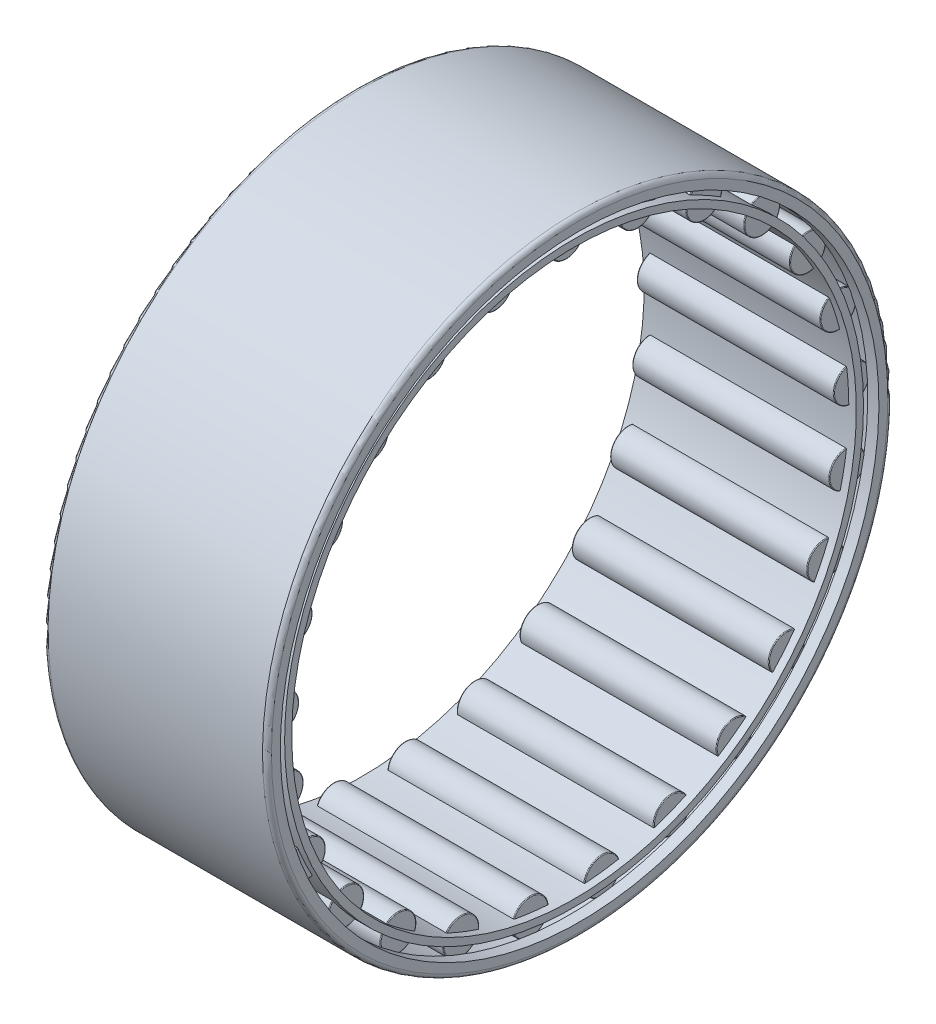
SolidWorks part; units mm, degrees
ref_plane "Plane1" through (0, 0, 0) normal (0, 0, 1) x (1, 0, 0)
ref_plane "Plane2" through (0, 0, 0) normal (0, 1, 0) x (1, 0, 0)
ref_plane "Plane3" through (0, 0, 0) normal (1, 0, 0) x (0, 0, -1)
other "Configuration Table"
sketch "Clipboard" plane through (0, 0, 0) normal (0, 0, 1) x (1, 0, 0)
  line L0 (-10, 0) -> (10, 0) construction
  line L1 (0, 0) -> (20.2657, -9.45)
  line L2 (0, 0) -> (36.8323, 17.1752)
  line L3 (0, 0) -> (20.2657, -9.45)
  line L4 (0, 0) -> (-76.2, -2.661)
sketch "InnRacSke" plane through (0, 0, 0) normal (0, 0, 1) x (1, 0, 0)
  line L0 (-14.2875, 42.545) -> (-15.875, 42.545)
  line L1 (-15.875, 42.545) -> (-15.875, 43.815)
  line L2 (-15.24, 44.45) -> (15.24, 44.45)
  line L4 (15.875, 43.815) -> (15.875, 42.545)
  line L5 (15.875, 42.545) -> (14.2875, 42.545)
  line L6 (14.2875, 42.545) -> (14.2875, 43.18)
  line L7 (14.2875, 43.18) -> (-14.2875, 43.18)
  line L8 (-14.2875, 43.18) -> (-14.2875, 42.545)
  line L9 (-31.75, 0) -> (31.75, 0) construction
  arc A0 (-15.875, 43.815) -> (-15.24, 44.45) centre (-15.24, 43.815) cw
  arc A2 (15.24, 44.45) -> (15.875, 43.815) centre (15.24, 43.815) cw
revolve "Race" add sketch "InnRacSke" angle 360 about L9
sketch "RolDetSke" plane through (0, 0, 0) normal (0, 0, 1) x (1, 0, 0)
  line L0 (-14.0018, 43.0789) -> (-14.0017, 40.64)
  line L1 (-14.0017, 40.64) -> (14.0017, 40.64)
  line L2 (14.0017, 40.64) -> (14.0018, 43.0789)
  line L3 (13.9001, 43.1805) -> (-13.9001, 43.1805)
  line L4 (-28.575, 40.64) -> (28.575, 40.64) construction
  arc A0 (14.0018, 43.0789) -> (13.9001, 43.1805) centre (13.9001, 43.0789) ccw
  arc A1 (-13.9001, 43.1805) -> (-14.0018, 43.0789) centre (-13.9001, 43.0789) ccw
revolve "RollerDetailed" add sketch "RolDetSke" angle 360 about L4
ref_axis "Axis1" through (-50, 0, 0) along (1, 0, 0)
sketch "CagSpiSke" plane through (0, 0, 0) normal (0, 0, 1) x (1, 0, 0)
  line L0 (15.0812, 40.1319) -> (15.0812, 41.1481)
  line L1 (15.0812, 41.1481) -> (-15.0813, 41.1481)
  line L2 (-15.0813, 41.1481) -> (-15.0813, 40.1319)
  line L3 (-15.0813, 40.1319) -> (15.0812, 40.1319)
  line L4 (-31.75, 0) -> (31.75, 0) construction
revolve "CageSpine" add sketch "CagSpiSke" angle 360 about L4
pattern_circular "RollersDetailed" count 25 every 14.4 about axis through (-50, 0, 0) along (1, 0, 0) of "RollerDetailed"
sketch "RolSimSke" plane through (0, 0, 0) normal (0, 0, 1) x (1, 0, 0)
  line L0 (-25.4, 0) -> (25.4, 0) construction
  line L2 (-13.9001, 43.181) -> (13.9001, 43.181)
  line L3 (-14.0018, 43.0794) -> (-14.0018, 38.2016)
  line L4 (-13.9001, 38.1) -> (13.9001, 38.1)
  line L5 (14.0017, 43.0794) -> (14.0017, 38.2016)
  arc A0 (-14.0018, 38.2016) -> (-13.9001, 38.1) centre (-13.9001, 38.2016) ccw
  arc A1 (-13.9001, 43.181) -> (-14.0018, 43.0794) centre (-13.9001, 43.0794) ccw
  arc A2 (14.0017, 43.0794) -> (13.9001, 43.181) centre (13.9001, 43.0794) ccw
  arc A3 (13.9001, 38.1) -> (14.0017, 38.2016) centre (13.9001, 38.2016) ccw
  point P10 (-14.0018, 38.1)
  point P15 (14.0017, 43.181)
  point P18 (14.0017, 38.1)
revolve "RollersSimplified" [suppressed] add sketch "RolSimSke" angle 360 about L0
equation "\"BallCLRad@Clipboard\" =  ( \"D1@InnRacSke\" + \"Bore@Clipboard\" )  / 4"
equation "\"RollerCLRad@RolDetSke\" = \"BallCLRad@Clipboard\""
equation "\"halfCyl@InnRacSke\" = \"Cyl_Len@InnRacSke\" / 2"
equation "\"Roller_length@RolDetSke\" = \"Cyl_Len@InnRacSke\" * .98"
equation "\"halfLength@RolDetSke\" = \"Roller_length@RolDetSke\" / 2"
equation "\"Roller_diameter@RolDetSke\" =  ( \"D1@InnRacSke\" - \"Bore@Clipboard\" )  / 2 + .001"
equation "\"Roller_radius@RolDetSke\" = \"Roller_diameter@RolDetSke\" / 50"
equation "\"Cage_width@CagSpiSke\" =  ( \"Cyl_Len@InnRacSke\" + \"Width@InnRacSke\" )  / 2"
equation "\"halfWidth@CagSpiSke\" = \"Cage_width@CagSpiSke\" / 2"
equation "\"Cage_thickness@CagSpiSke\"  = \"Roller_diameter@RolDetSke\" / 5"
equation "\"D2@CagSpiSke\" =  \"RollerCLRad@RolDetSke\" * 2 - \"Cage_thickness@CagSpiSke\""
equation "\"Roller_length@RolSimSke\" = \"Cyl_Len@InnRacSke\" * .98"
equation "\"halfWidth@RolSimSke\" = \"Roller_length@RolSimSke\" / 2"
equation "\"D1@RolSimSke\" = \"Roller_radius@RolDetSke\""
equation "\"Roller_diameter@RolSimSke\" =  ( \"D1@InnRacSke\" - \"Bore@Clipboard\" )  / 2 + .001"
equation "\"Bore@RolSimSke\" = \"Bore@Clipboard\""
equation "\"Max_count@Clipboard\" = int( 3.14159265 / atn(( \"Roller_diameter@RolDetSke\" / 2) / sqr( \"RollerCLRad@RolDetSke\"  *  \"RollerCLRad@RolDetSke\" - ( \"Roller_diameter@RolDetSke\" / 2) *  ( \"Roller_diameter@R"
equation "\"Max_count@Clipboard\" = ((sgn( \"Max_count@Clipboard\" - \"Count@Clipboard\" )-1)*( \"Max_count@Clipboard\" - \"Count@Clipboard\" ))/-2+ \"Count@Clipboard\""
equation "\"Count@RollersDetailed\" = int( \"Show_count@Clipboard\" ) "
equation "\"Count@RollersDetailed\" = ((sgn( \"Count@RollersDetailed\" - \"Max_count@Clipboard\" )-1)*( \"Count@RollersDetailed\" - \"Max_count@Clipboard\" ))/-2+ \"Max_count@Clipboard\""
equation "\"Count@RollersDetailed\" = ((sgn( \"Count@RollersDetailed\" - \"Min_count@Clipboard\" )+1)*( \"Count@RollersDetailed\" - \"Min_count@Clipboard\"))/2 +\"Min_count@Clipboard\""
equation "\"Angle@RollersDetailed\" = 360.0 / \"Max_count@Clipboard\""
equation "\"Angle@CageSpine\" =  \"Angle@RollersDetailed\" * ( \"Count@RollersDetailed\" -1 + int( \"Count@RollersDetailed\" / \"Max_count@Clipboard\" ) )  + 0.001 -  int( \"Count@RollersDetailed\" / \"Max_count@Clipboard\" "
equation "\"Angle@CageSpine\" =  \"Angle@CageSpine\" * int( \"Min_count@Clipboard\" / 2) + int(1 / \"Min_count@Clipboard\")  * 0.001"
